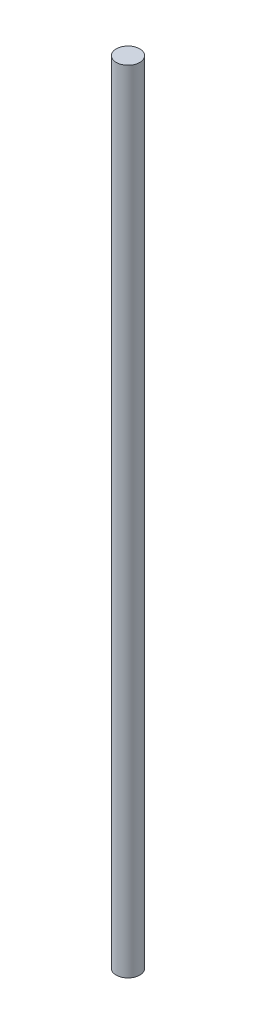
SolidWorks part; units mm, degrees
ref_plane "Alzado" through (0, 0, 0) normal (0, 0, 1) x (1, 0, 0)
ref_plane "Planta" through (0, 0, 0) normal (0, 1, 0) x (1, 0, 0)
ref_plane "Vista lateral" through (0, 0, 0) normal (1, 0, 0) x (0, 0, -1)
sketch "Croquis1" plane through (0, 0, 0) normal (0, 1, 0) x (1, 0, 0)
  circle A0 centre (0, 0) radius 5.95
  dimension "D1" = 11.9
extrude "Saliente-Extruir1" add sketch "Croquis1" along normal blind 399
